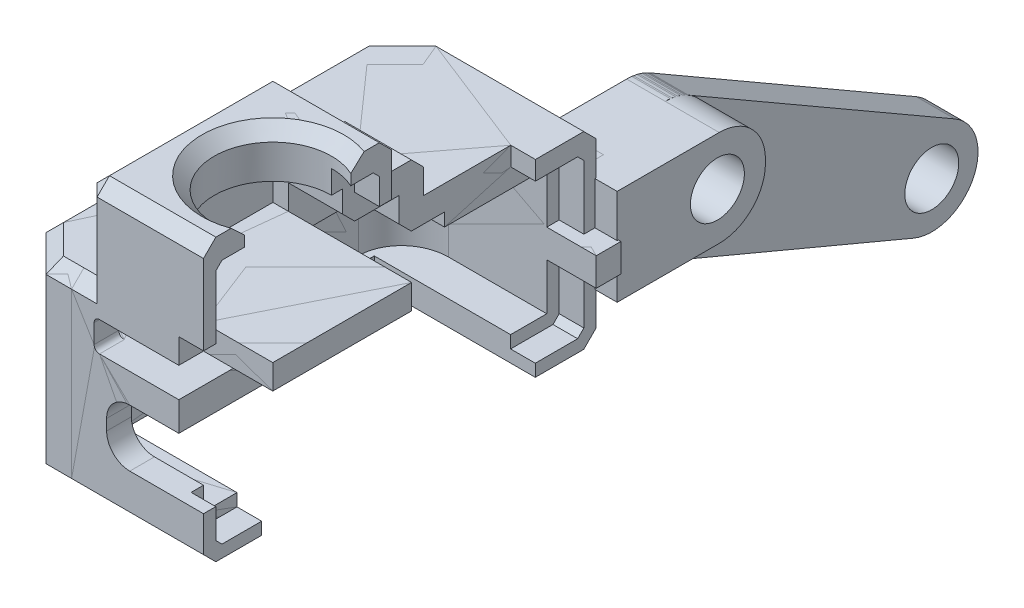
SolidWorks part; units mm, degrees
ref_plane "Front Plane" through (0, 0, 0) normal (0, 0, 1) x (1, 0, 0)
ref_plane "Top Plane" through (0, 0, 0) normal (0, 1, 0) x (1, 0, 0)
ref_plane "Right Plane" through (0, 0, 0) normal (1, 0, 0) x (0, 0, -1)
imported_body "Left (Open).ipt<1>"
sketch "Sketch1" plane through (0, 0, -21.1743) normal (0, 0, -1) x (-1, 0, 0)
  line L1 (-0.4614, 49.489) -> (0.5386, 49.489)
  line L2 (-0.4614, 49.489) -> (-0.4614, 36.271)
  line L3 (-0.4614, 36.271) -> (0.5386, 36.271)
  line L4 (0.5386, 49.489) -> (0.5386, 36.271)
  line L7 (3.0386, 42.88) -> (3.0386, 45.88) construction
  point P6 (0.5386, 42.88)
  dimension "D1" = 1
  dimension "D2" = 2.5
extrude "Cut-Extrude1" cut sketch "Sketch1" against normal blind 8
sketch "Sketch6" plane through (2.9614, 0, 0) normal (1, 0, 0) x (0, 0, -1)
  line L0 (11.5593, 45.88) -> (11.5593, 43.1125)
  line L1 (11.5593, 45.88) -> (11.5593, 43.1125) construction
  line L2 (11.5593, 43.1125) -> (11.5593, 45.88) construction
  line L3 (11.6367, 43.1125) -> (10.0367, 43.1125) construction
  line L4 (11.5593, 43.1125) -> (11.6367, 43.1125)
  line L5 (11.6367, 43.1125) -> (11.5593, 43.1125) construction
  line L6 (11.6367, 43.1125) -> (11.6367, 41.2825)
  line L7 (11.6367, 41.2825) -> (11.6367, 43.1125) construction
  line L8 (11.6367, 41.2825) -> (11.5593, 41.2825)
  line L9 (11.5593, 39.65) -> (11.5593, 41.2825) construction
  line L10 (11.6367, 41.2825) -> (10.0367, 41.2825) construction
  line L11 (11.5593, 41.2825) -> (11.5593, 39.65)
  line L12 (11.5593, 41.2825) -> (11.5593, 39.65) construction
  line L13 (11.5593, 39.65) -> (18.1743, 39.65)
  line L14 (11.5593, 39.65) -> (18.1743, 39.65) construction
  line L15 (18.1743, 39.65) -> (18.1743, 45.88)
  line L16 (18.1743, 45.88) -> (11.5593, 45.88)
  arc A0 (18.1743, 39.65) -> (21.1743, 42.65) centre (18.1743, 42.65) ccw construction
  circle A1 centre (18.1743, 42.765) radius 3.115
extrude "Cut-Extrude3" cut sketch "Sketch6" against normal blind 2.5 contours A1 M19 M20 M11 M12 M13 M14 M15 | L15 A1 M10 | L15 M16 M17 M18 M10 | L15 M10 | L15 M10
sketch "Sketch8" plane through (-3.0386, 0, 0) normal (-1, 0, 0) x (0, 0, 1)
  line L0 (-19.6743, 45.4781) -> (-36.9578, 35.4994)
  line L1 (-34.2964, 30.1353) -> (-11.6367, 39.65)
  line L2 (-11.6367, 45.88) -> (-18.1743, 45.88) construction
  line L4 (-11.6367, 39.65) -> (-11.6367, 45.88)
  line L5 (-11.6367, 45.88) -> (-18.1743, 45.88)
  line L6 (-21.1743, 42.88) -> (-21.1743, 42.65)
  line L7 (-18.1743, 39.65) -> (-11.6367, 39.65)
  line L10 (-21.1743, 42.88) -> (-21.1743, 42.65)
  line L11 (-18.1743, 39.65) -> (-11.6367, 39.65)
  arc A0 (-36.9578, 35.4994) -> (-34.2964, 30.1353) centre (-35.4578, 32.9014) ccw
  circle A1 centre (-35.4578, 32.9014) radius 1.75
  arc A2 (-18.1743, 45.88) -> (-21.1743, 42.88) centre (-18.1743, 42.88) ccw
  arc A3 (-21.1743, 42.65) -> (-18.1743, 39.65) centre (-18.1743, 42.65) ccw
  arc A4 (-19.6743, 45.4781) -> (-21.1743, 42.88) centre (-18.1743, 42.88) ccw
  arc A5 (-21.1743, 42.65) -> (-18.1743, 39.65) centre (-18.1743, 42.65) ccw
  circle A6 centre (-18.0593, 42.765) radius 1.75 construction
  dimension "D3" = 20
  dimension "D2" = 30
  dimension "D1" = 0
extrude "Boss-Extrude1" add sketch "Sketch8" against normal up to surface (2.5 mm away)
